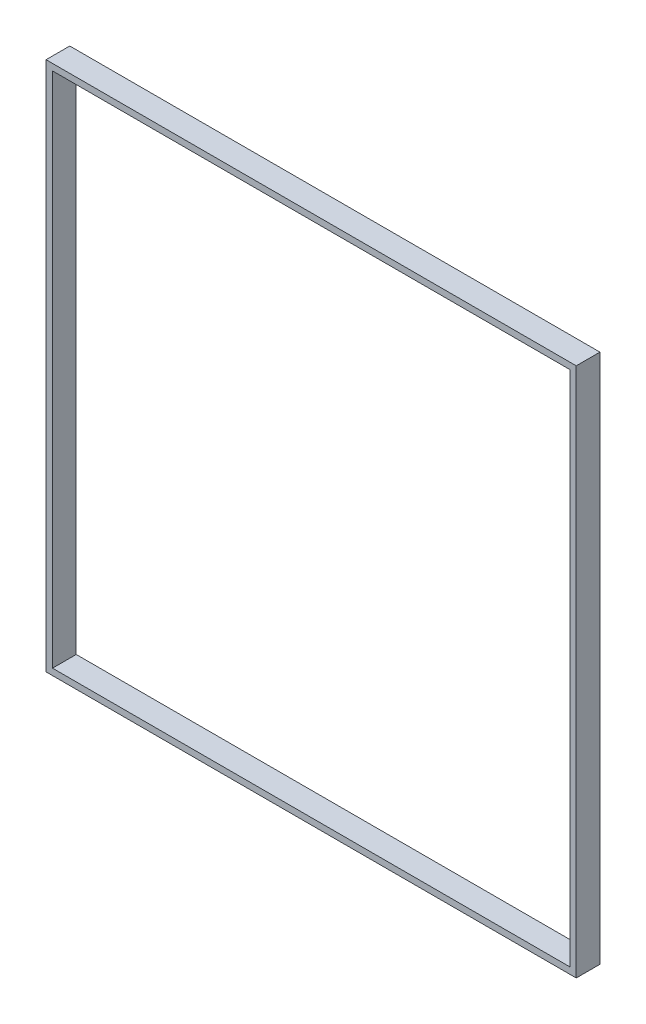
SolidWorks part; units mm, degrees
ref_plane "Front Plane" through (0, 0, 0) normal (0, 0, 1) x (1, 0, 0)
ref_plane "Top Plane" through (0, 0, 0) normal (0, 1, 0) x (1, 0, 0)
ref_plane "Right Plane" through (0, 0, 0) normal (1, 0, 0) x (0, 0, -1)
sketch "Sketch1" plane through (0, 0, 0) normal (0, 0, 1) x (1, 0, 0)
  line L0 (-1562.1, 1562.1) -> (1562.1, -1562.1) construction
  line L1 (-1562.1, 1562.1) -> (1562.1, 1562.1)
  line L2 (-1562.1, 1562.1) -> (-1562.1, -1562.1)
  line L3 (-1562.1, -1562.1) -> (1562.1, -1562.1)
  line L4 (1562.1, 1562.1) -> (1562.1, -1562.1)
  line L5 (1562.1, -1562.1) -> (1550.6446, -1486.3009) construction
  line L6 (-1524, 1524) -> (1524, 1524)
  line L7 (1524, 1524) -> (1524, -1524)
  line L8 (-1524, -1524) -> (1524, -1524)
  line L9 (-1524, 1524) -> (-1524, -1524)
  point P4 (0, 0)
  dimension "D1" = 3048
  dimension "D2" = 3048
  dimension "D3" = 38.1
extrude "Extrude1" add sketch "Sketch1" along normal blind 139.7
